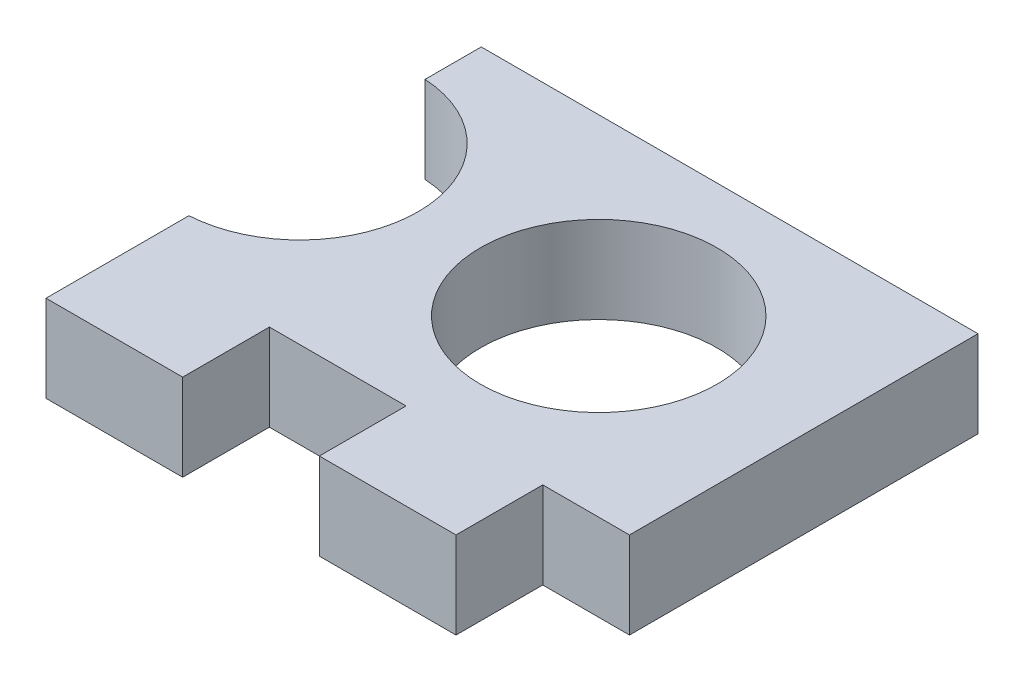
SolidWorks part; units mm, degrees
ref_plane "Front Plane" through (0, 0, 0) normal (0, 0, 1) x (1, 0, 0)
ref_plane "Top Plane" through (0, 0, 0) normal (0, 1, 0) x (1, 0, 0)
ref_plane "Right Plane" through (0, 0, 0) normal (1, 0, 0) x (0, 0, -1)
sketch "Sketch1" plane through (0, 0, 0) normal (0, 1, 0) x (1, 0, 0)
  line L0 (16.4102, -14.0551) -> (-9.5898, -14.0551) construction
  line L2 (-9.5898, -14.0551) -> (-9.5898, -8.5551) construction
  line L3 (-21.0898, -8.5551) -> (16.2908, -8.5551) construction
  line L5 (-21.0898, -8.5551) -> (-21.0898, 13.5449) construction
  line L6 (-21.0898, 13.5449) -> (16.4102, 13.5449) construction
  line L7 (16.4102, 13.5449) -> (16.4102, -8.5551) construction
  line L8 (16.4102, -8.5551) -> (21.9102, -8.5551) construction
  line L9 (21.9102, -8.5551) -> (21.9102, 13.5449) construction
  line L10 (21.9102, 13.5449) -> (16.4102, 13.5449) construction
  line L11 (-9.5898, -14.0551) -> (-0.9231, -14.0551) construction
  line L12 (16.4102, 13.5449) -> (1.4102, 13.5449) construction
  line L14 (-21.0898, 13.5449) -> (1.0102, 13.5449) construction
  line L15 (16.4102, -8.5551) -> (16.4102, -14.0551) construction
  line L18 (1.4102, 13.5449) -> (1.4102, -8.5551) construction
  line L19 (1.4102, 2.4949) -> (16.4102, 2.4949) construction
  line L20 (-21.0898, 13.5449) -> (1.0102, -8.5551) construction
  line L37 (-21.0898, -8.5551) -> (1.0102, 13.5449) construction
  line L38 (16.4102, -14.0551) -> (7.7435, -14.0551) construction
  line L39 (-0.9231, -14.0551) -> (-0.9231, -8.5551) construction
  line L40 (7.7435, -14.0551) -> (7.7435, -8.5551) construction
  line L41 (-9.5898, -8.5551) -> (-9.5898, -14.0551)
  line L42 (-9.5898, -14.0551) -> (-0.9231, -14.0551)
  line L43 (-0.9231, -14.0551) -> (-0.9231, -8.5551)
  line L44 (-0.9231, -8.5551) -> (7.7435, -8.5551)
  line L45 (7.7435, -8.5551) -> (7.7435, -14.0551)
  line L46 (7.7435, -14.0551) -> (16.4102, -14.0551)
  line L47 (16.4102, -14.0551) -> (16.4102, -8.5551)
  line L48 (16.4102, -8.5551) -> (21.9102, -8.5551)
  line L49 (21.9102, -8.5551) -> (21.9102, 13.5449)
  line L50 (21.9102, 13.5449) -> (-9.5898, 13.5449)
  line L51 (-9.5898, 13.5449) -> (-9.5898, 9.9814)
  line L54 (-9.5898, -8.5551) -> (-9.5898, -4.9916)
  circle A1 centre (8.9102, 2.4949) radius 7.5
  arc A3 (-9.5898, -4.9916) -> (-9.5898, 9.9814) centre (-10.0398, 2.4949) ccw
  dimension "D1" = 15.4
  dimension "D2" = 5.5
extrude "Boss-Extrude3" add sketch "Sketch1" along normal blind 5.5
